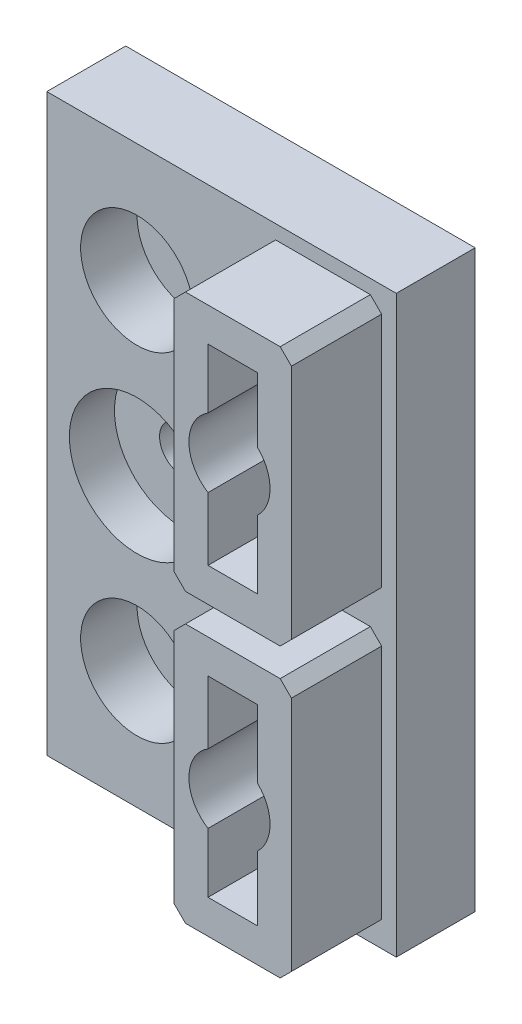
SolidWorks part; units mm, degrees
ref_plane "前视基准面" through (0, 0, 0) normal (0, 0, 1) x (1, 0, 0)
ref_plane "上视基准面" through (0, 0, 0) normal (0, 1, 0) x (1, 0, 0)
ref_plane "右视基准面" through (0, 0, 0) normal (1, 0, 0) x (0, 0, -1)
sketch "草图1" plane through (0, 0, 0) normal (0, 0, 1) x (1, 0, 0)
  line L0 (0, 0) -> (0, 15)
  line L2 (-8, 25.8) -> (22.7, 25.8)
  line L3 (-8, 25.8) -> (22.704, 25.8)
  line L4 (-8, 25.8) -> (-8, -25.8)
  line L5 (-8, 25.8) -> (-8, -25.8)
  line L6 (-8, -25.8) -> (22.7, -25.8)
  line L7 (0, 15) -> (0, -15)
  line L8 (-5, 15) -> (-8, 15)
  line L9 (-8, 15) -> (-8, 28.4964)
  line L10 (-8, 28.4964) -> (-8, -25.8)
  line L11 (22.7, 25.8) -> (22.7, -25.8)
  line L13 (-8, 25.8) -> (-8, -25.8)
  circle A0 centre (0, 15) radius 5
  circle A1 centre (0, -15) radius 5
  point P0 (0, 0)
extrude "凸台-拉伸1" add sketch "草图1" along normal blind 5
sketch "草图2" plane through (0, 0, 5) normal (0, 0, 1) x (1, 0, 0)
  line L0 (18.204, 4.4) -> (14.204, 4.4)
  line L1 (21.204, -24.4) -> (11.204, -24.4)
  line L2 (21.204, -24.4) -> (21.204, -1.4)
  line L3 (21.204, -1.4) -> (11.204, -1.4)
  line L4 (11.204, -24.4) -> (11.204, -1.4)
  line L5 (21.204, 1.4) -> (11.204, 1.4)
  line L6 (21.204, 1.4) -> (21.204, 24.4)
  line L7 (21.204, 24.4) -> (11.204, 24.4)
  line L8 (11.204, 1.4) -> (11.204, 24.4)
  line L9 (14.204, 4.4) -> (14.204, 21.4)
  line L10 (18.204, 21.4) -> (14.204, 21.4)
  line L11 (18.204, 4.4) -> (18.204, 21.4)
  line L12 (18.204, -21.4) -> (14.204, -21.4)
  line L13 (14.204, -21.4) -> (14.204, -4.4)
  line L14 (18.204, -4.4) -> (14.204, -4.4)
  line L15 (18.204, -21.4) -> (18.204, -4.4)
  dimension "D1" = 3
  dimension "D2" = 3
extrude "凸台-拉伸2" add sketch "草图2" along normal blind 7
sketch "草图4" plane through (0, 0, 0) normal (0, 0, -1) x (-1, 0, 0)
  line L1 (-22.704, 25.8) -> (8, 25.8)
  line L2 (-22.704, 25.8) -> (-22.704, -25.8)
  line L3 (-22.704, -25.8) -> (8, -25.8)
  line L4 (8, 25.8) -> (8, -25.8)
extrude "凸台-拉伸4" add sketch "草图4" along normal blind 2
sketch "草图5" plane through (0, 0, 5) normal (0, 0, 1) x (1, 0, 0)
  circle A0 centre (0, 0) radius 2
extrude "切除-拉伸1" cut sketch "草图5" against normal blind 10
sketch "草图6" plane through (0, 0, 5) normal (0, 0, 1) x (1, 0, 0)
  circle A0 centre (0, 0) radius 6
extrude "切除-拉伸2" cut sketch "草图6" against normal blind 4
sketch "草图7" plane through (0, 0, 0) normal (0, 0, 1) x (1, 0, 0)
  circle A0 centre (0, 15) radius 1
  circle A1 centre (0, -15) radius 1
extrude "切除-拉伸3" cut sketch "草图7" against normal blind 10
sketch "草图11" plane through (0, 0, 12) normal (0, 0, 1) x (1, 0, 0)
  line L0 (14.204, 21.4) -> (18.204, 4.4)
  line L1 (18.204, -4.4) -> (14.204, -21.4)
  circle A0 centre (16.204, 12.9) radius 3.6
  circle A1 centre (16.204, -12.9) radius 3.6
extrude "切除-拉伸8" cut sketch "草图11" against normal offset from surface (10.5 mm away) 3.5 contours L0 A0 M8 | A0 M6 | A0 L0 M6 | L1 A1 | L1 A1 | A0 M8
sketch "草图12" plane through (0, 0, 1.5) normal (0, 0, 1) x (1, 0, 0)
  circle A0 centre (16.204, 12.9) radius 1
  circle A1 centre (16.204, -12.9) radius 1
extrude "切除-拉伸9" cut sketch "草图12" against normal blind 12.5
chamfer "倒角1" distance 2 angle 45 8 edges at (11.204, -24.4, 8.5) (21.204, -24.4, 8.5) (21.204, -1.4, 8.5) (11.204, -1.4, 8.5) (21.204, 1.4, 8.5) (11.204, 1.4, 8.5) (21.204, 24.4, 8.5) (11.204, 24.4, 8.5)
sketch "草图13" plane through (0, 0, 5) normal (0, 0, 1) x (1, 0, 0)
  circle A0 centre (10, 0) radius 1
extrude "切除-拉伸10" cut sketch "草图13" against normal blind 11
sketch "草图14" plane through (0, 0, 5) normal (0, 0, 1) x (1, 0, 0)
  line L1 (-8, 25.8) -> (32.0443, 25.8)
  line L2 (-8, 25.8) -> (-8, 25.65)
  line L3 (-8, 25.65) -> (32.0443, 25.65)
  line L4 (32.0443, 25.8) -> (32.0443, 25.65)
  line L5 (-8, -25.8) -> (27.6717, -25.8)
  line L6 (-8, -25.8) -> (-8, -25.66)
  line L7 (-8, -25.66) -> (27.6717, -25.66)
  line L8 (27.6717, -25.8) -> (27.6717, -25.66)
extrude "切除-拉伸11" cut sketch "草图14" against normal blind 11
sketch "草图15" plane through (0, 0, 5) normal (0, 0, 1) x (1, 0, 0)
  line L0 (-8, 25.65) -> (-8, -25.66) construction
  line L1 (22.704, 25.65) -> (-8, 25.65)
  line L2 (22.704, 25.65) -> (22.704, 25.3228)
  line L3 (22.704, 25.3228) -> (-8, 25.3228)
  line L4 (-8, 25.65) -> (-8, 25.3228)
extrude "切除-拉伸12" cut sketch "草图15" against normal blind 10
sketch "草图18" plane through (0, 0, 5) normal (0, 0, 1) x (1, 0, 0)
  line L0 (0, 0) -> (-8, 0)
  line L1 (-8, 25.3228) -> (-8, -25.66) construction
  line L2 (-8, 0) -> (-8, -25.5)
  line L3 (-8, -25.5) -> (22.7018, -25.5)
  line L4 (22.703, -25.3952) -> (23.9207, -24.607)
  line L5 (-8, -25.66) -> (21.9551, -25.66)
  line L6 (-8, -25.66) -> (-8, -25.5)
  line L7 (-8, -25.5) -> (22.7018, -25.5)
  line L8 (23.7322, -25.66) -> (23.7322, -25.5)
  line L9 (22.703, -25.66) -> (22.702, 25.3228) construction
  line L11 (22.391, -26.071) -> (24.5176, -27.6801)
  line L12 (24.5176, -27.6801) -> (23.9207, -24.607)
  line L13 (21.9551, -25.66) -> (22.391, -26.071)
  line L14 (22.391, -26.071) -> (22.3916, -26.0739)
extrude "切除-拉伸13" cut sketch "草图18" against normal blind 10 contours L3 M2 M3 M4
sketch "草图19" plane through (-8, 0, 0) normal (-1, 0, 0) x (0, 0, 1)
  line L1 (-2, -25.5) -> (1.8754, -25.5)
  line L2 (-2, -25.5) -> (-2, -26.747)
  line L3 (-2, -26.747) -> (1.8754, -26.747)
  line L4 (1.8754, -25.5) -> (1.8754, -26.747)
extrude "切除-拉伸16" cut sketch "草图19" against normal blind 38
sketch "草图20" plane through (0, 0, 5) normal (0, 0, 1) x (1, 0, 0)
  line L0 (0, 0) -> (-8, 0)
  line L1 (-8, 25.3228) -> (-8, -25.5) construction
  line L2 (-8, 0) -> (-8, 25.5)
  line L3 (-8, 25.5) -> (23, 25.5)
  line L4 (23, 25.5) -> (23, -25.5)
  line L5 (23, -25.5) -> (22.7, -25.5)
  line L10 (-8, 25.3228) -> (-8, -25.5)
  line L11 (-8, -25.5) -> (22.7, -25.5)
  line L12 (22.7, -25.5) -> (22.7, 25.3228)
  line L13 (22.7, 25.3228) -> (-8, 25.3228)
  line L14 (-8, 25.3228) -> (-8, -25.5)
  line L15 (-8, -25.5) -> (22.7, -25.5)
  line L16 (22.7, -25.5) -> (22.7, 25.3228)
  line L17 (22.7, 25.3228) -> (-8, 25.3228)
  dimension "D1" = 0
extrude "凸台-拉伸5" add sketch "草图20" against normal up to surface (7 mm away) contours L5 L4 L3 L2 M28 M27
sketch "草图21" plane through (0, 0, 12) normal (0, 0, 1) x (1, 0, 0)
  line L1 (7.7069, 27.0003) -> (36.4737, 27.0003)
  line L2 (7.7069, 27.0003) -> (7.7069, -27.7124)
  line L3 (7.7069, -27.7124) -> (36.4737, -27.7124)
  line L4 (36.4737, 27.0003) -> (36.4737, -27.7124)
extrude "切除-拉伸17" cut sketch "草图21" against normal up to surface (7 mm away)
sketch "草图22" plane through (0, 0, 5) normal (0, 0, 1) x (1, 0, 0)
  line L0 (18.7, -21.25) -> (14.3, -21.25)
  line L1 (21.7, -24.25) -> (11.3, -24.25)
  line L2 (21.7, -24.25) -> (21.7, -1.25)
  line L3 (21.7, -1.25) -> (11.3, -1.25)
  line L4 (11.3, -24.25) -> (11.3, -1.25)
  line L5 (21.7, 1.25) -> (11.3, 1.25)
  line L6 (21.7, 1.25) -> (21.7, 24.25)
  line L7 (21.7, 24.25) -> (11.3, 24.25)
  line L8 (11.3, 1.25) -> (11.3, 24.25)
  line L9 (14.3, -21.25) -> (14.3, -4.25)
  line L10 (18.7, -4.25) -> (14.3, -4.25)
  line L11 (18.7, -21.25) -> (18.7, -4.25)
  line L12 (18.7, 4.25) -> (14.3, 4.25)
  line L13 (14.3, 4.25) -> (14.3, 21.25)
  line L14 (18.7, 21.25) -> (14.3, 21.25)
  line L15 (18.7, 4.25) -> (18.7, 21.25)
  circle A0 centre (16.204, -12.9) radius 3.6 construction
  circle A1 centre (16.204, -12.9) radius 3.6
  circle A2 centre (16.204, 12.9) radius 3.6 construction
  circle A3 centre (16.204, 12.9) radius 3.6
  circle A4 centre (16.204, -12.9) radius 0.6
  circle A5 centre (16.204, 12.9) radius 0.6
  dimension "D1" = 3
extrude "凸台-拉伸6" add sketch "草图22" along normal blind 8 contours L8 L5 L6 L7 L15 L12 L13 L14 M1 | L4 L1 L2 L3 L11 L0 L9 L10 M2
chamfer "倒角2" distance 1 angle 45 8 edges at (21.7, -24.25, 9) (11.3, -24.25, 9) (11.3, -1.25, 9) (21.7, -1.25, 9) (11.3, 1.25, 9) (21.7, 1.25, 9) (21.7, 24.25, 9) (11.3, 24.25, 9)
